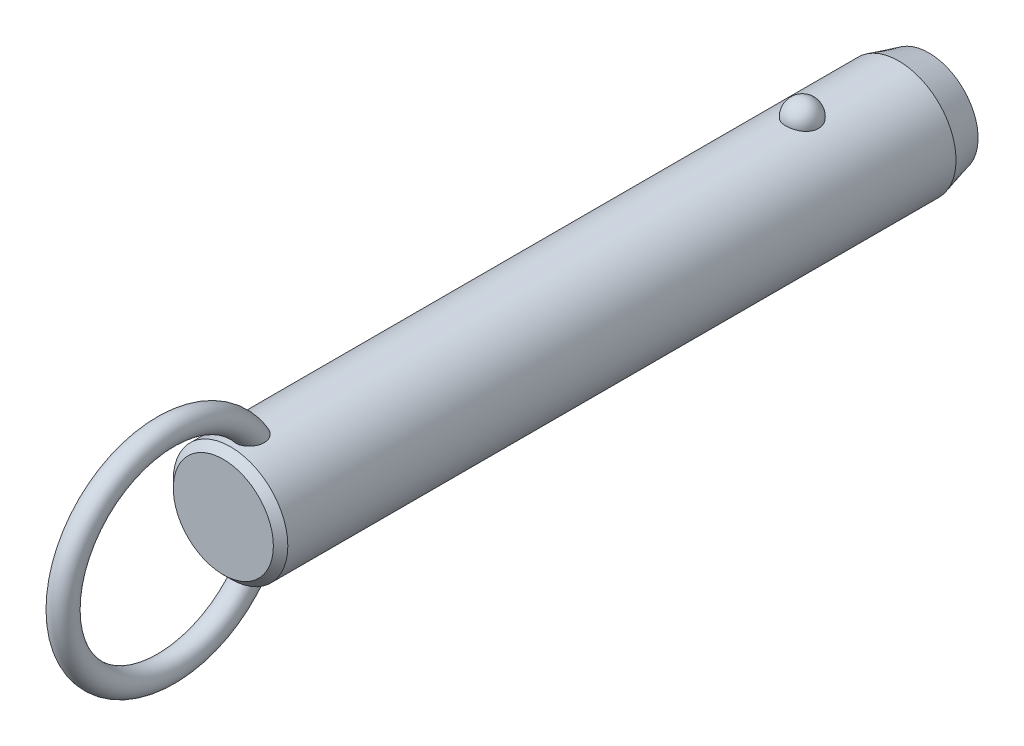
SolidWorks part; units mm, degrees
ref_plane "Front Plane" through (0, 0, 0) normal (0, 0, 1) x (1, 0, 0)
ref_plane "Top Plane" through (0, 0, 0) normal (0, 1, 0) x (1, 0, 0)
ref_plane "Right Plane" through (0, 0, 0) normal (1, 0, 0) x (0, 0, -1)
sketch "Sketch2" plane through (0, 0, 0) normal (0, 0, 1) x (1, 0, 0)
  circle A0 centre (0, 0) radius 9.5
  point P3 (0, 9.5)
  dimension "D1" = 19
extrude "Boss-Extrude1" add sketch "Sketch2" along normal blind 83.8
sketch "Sketch3" plane through (0, 0, 0) normal (0, 0, -1) x (-1, 0, 0)
  circle A0 centre (0, 0) radius 9.5
  dimension "D1" = 19
extrude "Boss-Extrude2" add sketch "Sketch3" along normal blind 23.7
chamfer "Chamfer1" distance 5 angle 15 1 edges at (-9.5, 0, -23.7)
sketch "Sketch12" plane through (0, 0, 0) normal (1, 0, 0) x (0, 0, -1)
  line L0 (-83.8, 9.5) -> (-83.8, -9.5) construction
  point P0 (-83.8, 0)
sketch "Sketch13" plane through (0, 0, 0) normal (1, 0, 0) x (0, 0, -1)
  circle A0 centre (-102.85, 0) radius 19.05
  point P2 (-83.8, 0)
  dimension "D1" = 38.1
sketch "Sketch14" plane through (0, 0, 0) normal (0, 1, 0) x (1, 0, 0)
  circle A0 centre (0, -85.8) radius 2
  point P2 (0, -83.8)
  dimension "D1" = 4
sweep "Sweep1" add profiles "Sketch14" path "Sketch13"
sketch "Sketch15" plane through (0, 0, 83.8) normal (0, 0, 1) x (1, 0, 0)
  circle A0 centre (0, 0) radius 9.5
  dimension "D1" = 19
extrude "Boss-Extrude3" add sketch "Sketch15" along normal blind 9.52
chamfer "Chamfer2" distance 1.2 angle 45 1 edges at (9.5, 0, 93.32)
sketch "Sketch18" plane through (0, 0, 0) normal (1, 0, 0) x (0, 0, -1)
  line L0 (18.7, 9.5) -> (-86.3378, 9.5) construction
  line L1 (2.7, 12.2) -> (2.7, 6.8)
  line L2 (-86.3378, -9.5) -> (18.7, -9.5) construction
  arc A0 (2.7, 12.2) -> (2.7, 6.8) centre (2.7, 9.5) ccw
  point P4 (0, 9.5)
  dimension "D1" = 21.7
revolve "Revolve1" add sketch "Sketch18" angle 360 about L1
